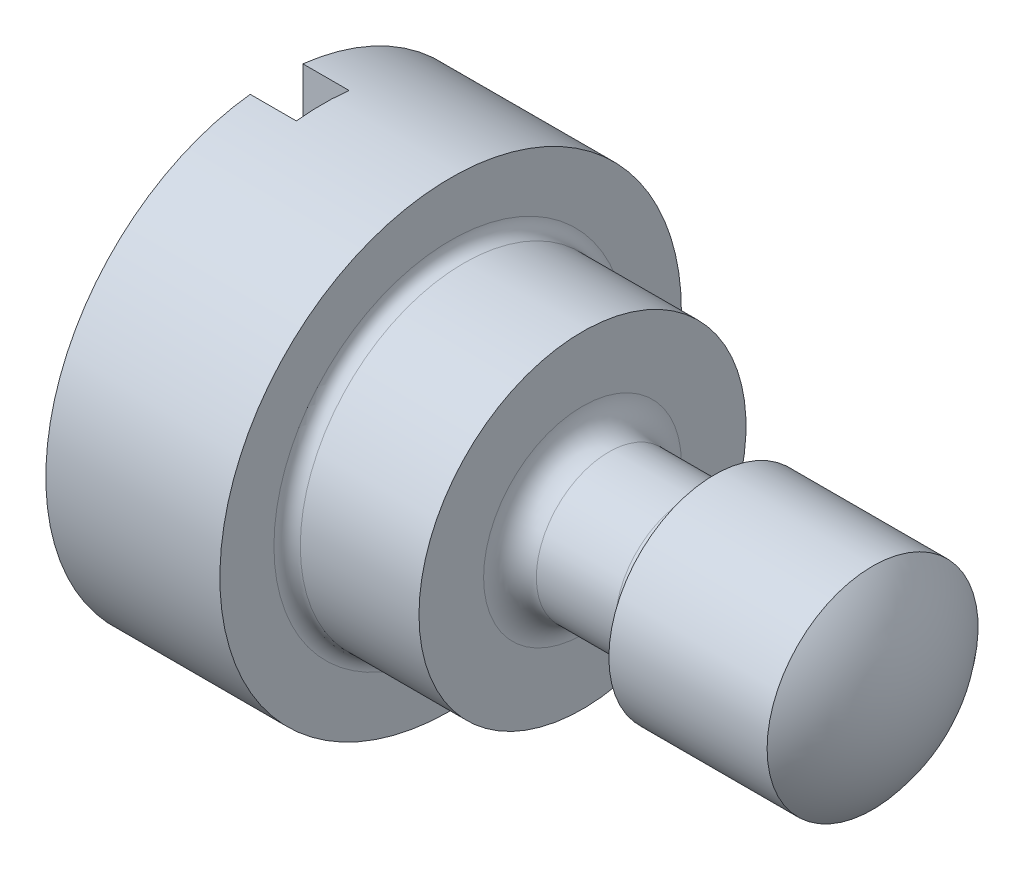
SolidWorks part; units mm, degrees
ref_plane "Front" through (0, 0, 0) normal (0, 0, 1) x (1, 0, 0)
ref_plane "Top" through (0, 0, 0) normal (0, 1, 0) x (1, 0, 0)
ref_plane "Right" through (0, 0, 0) normal (1, 0, 0) x (0, 0, -1)
sketch "Sketch1" plane through (0, 0, 0) normal (1, 0, 0) x (0, 0, -1)
  circle A0 centre (0, 0) radius 1.75
extrude "BaseHead" add sketch "Sketch1" along normal blind 1.32
sketch "Sketch2" plane through (0.1968, 0, 0.1968) normal (0, 1, 0) x (0, 0, 1)
  line L1 (-0.3968, -0.1968) -> (0.0032, -0.1968)
  line L2 (-0.3968, -0.1968) -> (-0.3968, 0.1532)
  line L3 (-0.3968, 0.1532) -> (0.0032, 0.1532)
  line L4 (0.0032, -0.1968) -> (0.0032, 0.1532)
  line L5 (-0.1968, -1.4104) -> (-0.1968, 1.0169) construction
  dimension "t" = 0.35
  dimension "n" = 0.4
extrude "Slot" cut sketch "Sketch2" against normal through all and the other way through all
sketch "Sketch4" plane through (0, 0, 0) normal (0, 0, 1) x (1, 0, 0)
  line L0 (-0.6595, 0) -> (4.82, 0) construction
  line L1 (1.32, 1.24) -> (2.32, 1.24)
  line L2 (4.82, 0) -> (1.32, 0)
  line L3 (1.32, -1.75) -> (1.32, 1.75) construction
  line L4 (1.32, 1.24) -> (1.32, 0)
  line L5 (3.32, 0.8) -> (4.52, 0.8)
  line L6 (2.32, 1.24) -> (2.32, 0.75)
  line L9 (2.52, 0.55) -> (3.12, 0.55)
  line L10 (3.32, 0.75) -> (3.32, 0.8)
  arc A0 (4.52, 0.8) -> (4.82, 0) centre (3.6033, 0) cw
  arc A1 (2.32, 0.75) -> (2.52, 0.55) centre (2.52, 0.75) ccw
  arc A2 (3.12, 0.55) -> (3.32, 0.75) centre (3.12, 0.75) ccw
  dimension "r1" = 0.2
  dimension "l" = 1
  dimension "s" = 0.3
  dimension "a" = 1
  dimension "d" = 1.6
  dimension "d1" = 2.48
  dimension "b" = 2.5
  dimension "d2" = 1.1
revolve "BaseBody" add sketch "Sketch4" angle 360 about L0
fillet "Fillet1" radius 0.1 1 edges at (1.32, 0, 1.24)
sketch "Sketch5" plane through (0, 0, 0) normal (0, 0, 1) x (1, 0, 0)
  line L0 (4.52, 0.6359) -> (4.6147, 0.8)
  line L1 (4.6147, 0.8) -> (4.6147, 0.9895)
  line L2 (4.6147, 0.9895) -> (4.4252, 0.9895)
  line L3 (4.4252, 0.9895) -> (4.4252, 0.8)
  line L4 (4.4252, 0.8) -> (4.52, 0.6359)
  line L5 (0, 0) -> (6.0976, 0) construction
  line L6 (4.52, 0.8) -> (4.52, -0.8) construction
  line L7 (4.52, 0.8) -> (3.32, 0.8) construction
  dimension "D1" = 0.1895
revolve "Cut-Revolve10" [suppressed] cut sketch "Sketch5" angle 360 about L5
pattern_linear "LPattern10" [suppressed] count 7 spacing 0.2274 along (1, 0, 0)
equation "\"D1@Sketch5\" = (  \"d@Sketch4\" - \"D2@ThreadCosmetic1\" )  / 2"
equation "\"D3@LPattern10\" = \"D1@Sketch5\" * 1.2"
equation "\"D1@LPattern10\" =  ( \"b@Sketch4\" - \"a@Sketch4\" )  / \"D3@LPattern10\""
